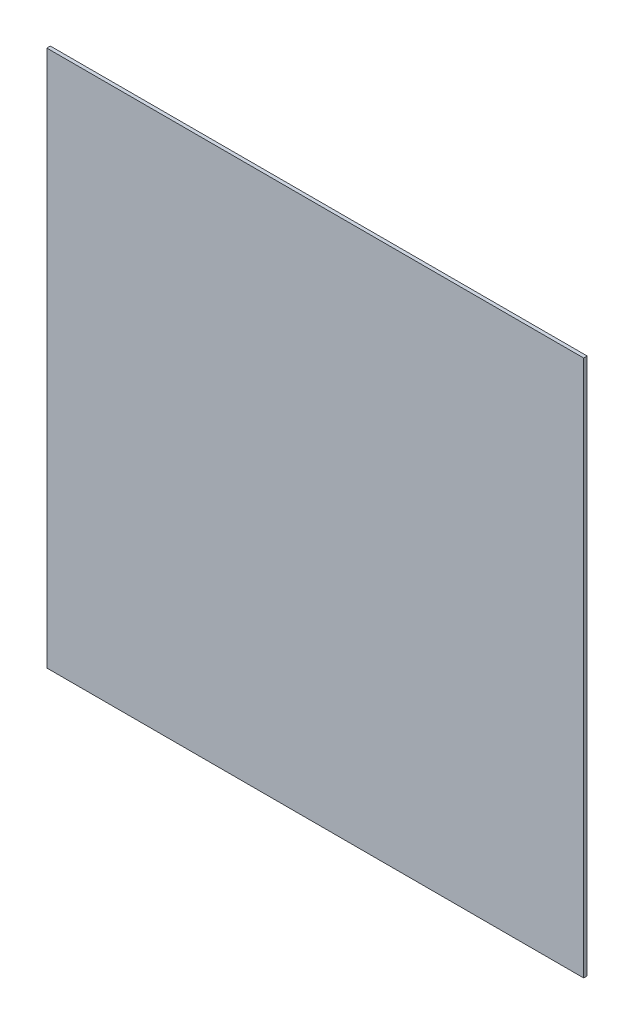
SolidWorks part; units mm, degrees
ref_plane "Front Plane" through (0, 0, 0) normal (0, 0, 1) x (1, 0, 0)
ref_plane "Top Plane" through (0, 0, 0) normal (0, 1, 0) x (1, 0, 0)
ref_plane "Right Plane" through (0, 0, 0) normal (1, 0, 0) x (0, 0, -1)
sketch "Sketch1" plane through (0, 0, 0) normal (0, 0, 1) x (1, 0, 0)
  line L1 (0, 0) -> (1524, 0)
  line L2 (0, 0) -> (0, 1524)
  line L3 (0, 1524) -> (1524, 1524)
  line L4 (1524, 0) -> (1524, 1524)
  dimension "D1" = 1524
extrude "Boss-Extrude1" add sketch "Sketch1" along normal blind 10
